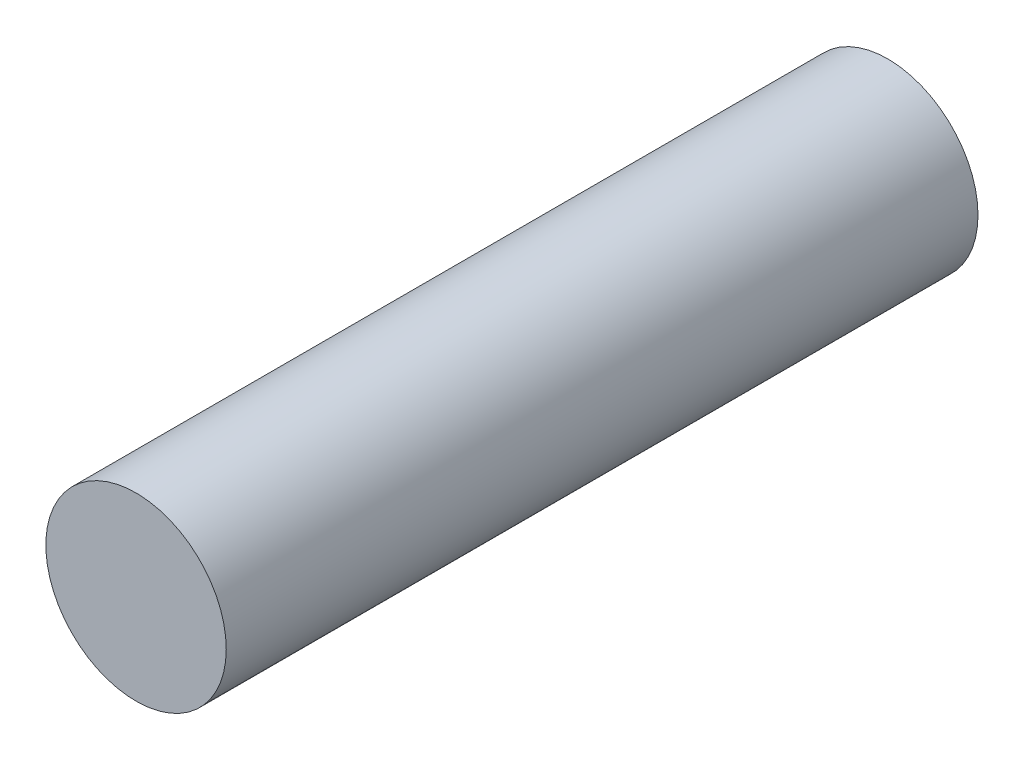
SolidWorks part; units mm, degrees
ref_plane "Front Plane" through (0, 0, 0) normal (0, 0, 1) x (1, 0, 0)
ref_plane "Top Plane" through (0, 0, 0) normal (0, 1, 0) x (1, 0, 0)
ref_plane "Right Plane" through (0, 0, 0) normal (1, 0, 0) x (0, 0, -1)
sketch "Sketch1" plane through (0, 0, 0) normal (0, 0, 1) x (1, 0, 0)
  circle A0 centre (0, 0) radius 30
  dimension "D1" = 60
extrude "Boss-Extrude1" add sketch "Sketch1" against normal blind 250
